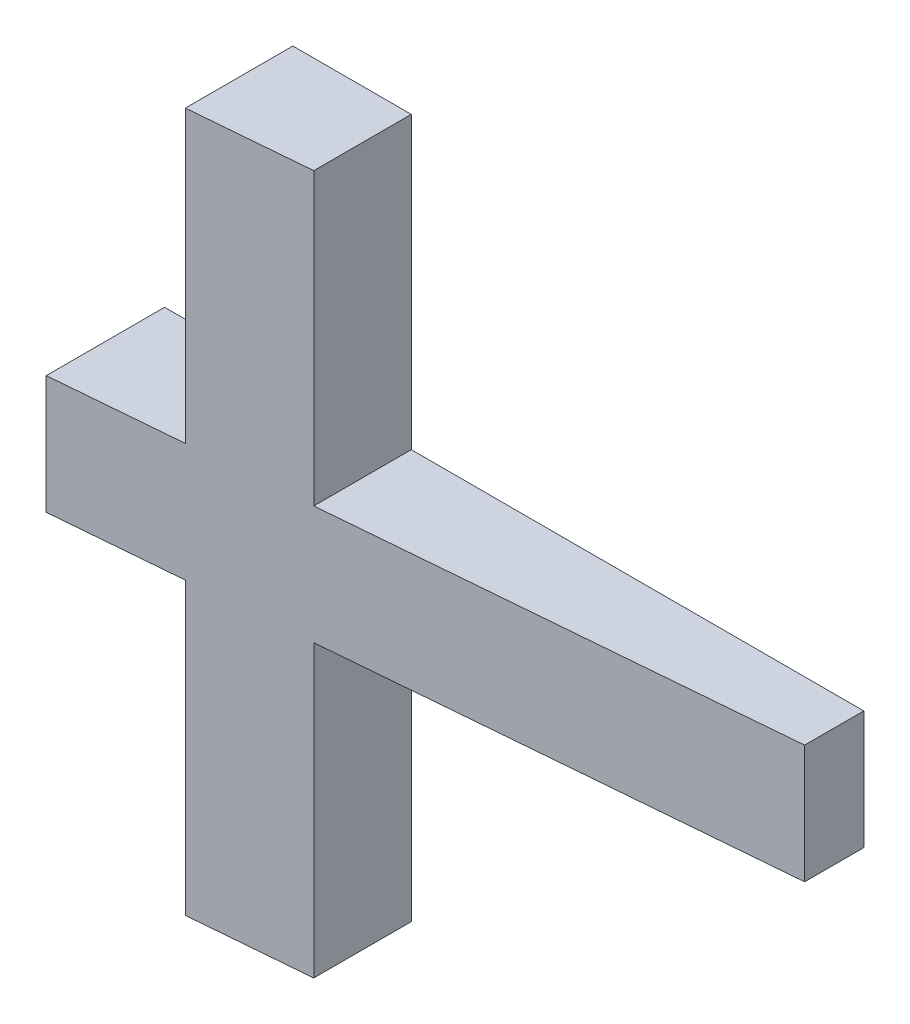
SolidWorks part; units mm, degrees
ref_plane "Front Plane" through (0, 0, 0) normal (1, 0, 0) x (0, 1, 0)
ref_plane "Top Plane" through (0, 0, 0) normal (0, 0, 1) x (0, 1, 0)
ref_plane "Right Plane" through (0, 0, 0) normal (0, 1, 0) x (-1, 0, 0)
sketch "Sketch1" plane through (0, 0, 0) normal (0, 0, 1) x (0, 1, 0)
  line L0 (-304.8, 965.2) -> (304.8, 965.2)
  line L1 (304.8, 965.2) -> (304.8, 304.8)
  line L2 (304.8, 304.8) -> (1800, 304.8)
  line L3 (1800, 304.8) -> (1800, -304.8)
  line L4 (1800, -304.8) -> (304.8, -304.8)
  line L5 (304.8, -304.8) -> (304.8, -2634.8)
  line L6 (304.8, -2634.8) -> (-304.8, -2634.8)
  line L7 (-304.8, -2634.8) -> (-304.8, -304.8)
  line L8 (-304.8, -304.8) -> (-1800, -304.8)
  line L9 (-1800, -304.8) -> (-1800, 304.8)
  line L10 (-1800, 304.8) -> (-304.8, 304.8)
  line L11 (-304.8, 304.8) -> (-304.8, 965.2)
  line L12 (-1800, 0) -> (1800, 0) construction
  point P2 (0, 965.2)
  point P13 (1800, 0)
  point P15 (-1800, 0)
  point P16 (0, -2634.8)
  point P19 (0, 0)
  dimension "D1" = 609.6
  dimension "D2" = 3600
  dimension "D3" = 2330
  dimension "D4" = 3600
  dimension "D5" = 609.6
extrude "Boss-Extrude1" add sketch "Sketch1" along normal blind 609.6
sketch "Sketch2" plane through (0, 0, 0) normal (0, 1, 0) x (-1, 0, 0)
  line L0 (965.2, 609.6) -> (-2634.8, 304.8)
  line L1 (-2634.8, 609.6) -> (-2634.8, 0) construction
  line L2 (-2634.8, 304.8) -> (-2634.8, 1077.3064)
  line L3 (-2634.8, 1077.3064) -> (965.2, 609.6)
extrude "Cut-Extrude1" cut sketch "Sketch2" against normal through all both and the other way through all
